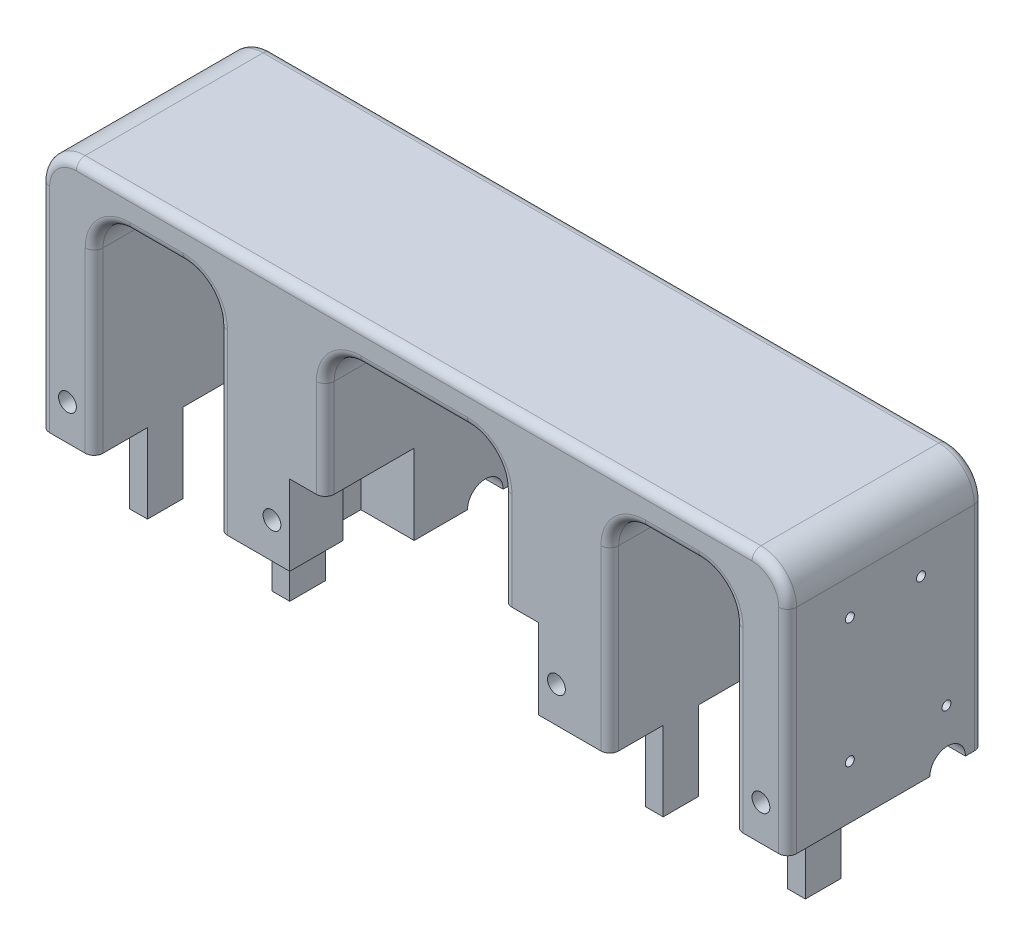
SolidWorks part; units mm, degrees
ref_plane "Front Plane" through (0, 0, 0) normal (0, 0, 1) x (1, 0, 0)
ref_plane "Top Plane" through (0, 0, 0) normal (0, 1, 0) x (1, 0, 0)
ref_plane "Right Plane" through (0, 0, 0) normal (1, 0, 0) x (0, 0, -1)
sketch "Sketch1" plane through (0, 0, 0) normal (0, 0, 1) x (1, 0, 0)
  line L5 (533.4, 406.4) -> (0, 406.4)
  line L7 (533.4, 406.4) -> (533.4, 533.4)
  line L8 (533.4, 533.4) -> (0, 533.4)
  line L9 (0, 406.4) -> (0, 533.4)
  line L10 (0, 406.4) -> (0, 0)
  line L16 (533.4, 406.4) -> (533.4, 0)
  line L17 (533.4, 406.4) -> (0, 533.4) construction
  line L18 (533.4, 0) -> (0, 0)
  line L19 (533.4, 533.4) -> (0, 406.4) construction
  line L24 (0, 406.4) -> (533.4, 406.4)
  point P2 (266.7, 469.9)
  dimension "D1" = 406.4
  dimension "D2" = 533.4
  dimension "D3" = 127
extrude "Boss-Extrude1" add sketch "Sketch1" along normal blind 139.7 contours L24 L10 L18 L16 | L9 L5 L7 L8
sketch "Sketch3" plane through (0, 533.4, 0) normal (0, 1, 0) x (1, 0, 0)
  line L0 (127, -101.6) -> (139.7, -101.6)
  line L1 (406.4, -101.6) -> (393.7, -101.6)
  line L2 (0, -139.7) -> (0, 0) construction
  line L3 (355.6, -101.6) -> (368.3, -101.6)
  line L6 (355.6, -155.448) -> (177.8, -155.448)
  line L8 (533.4, 0) -> (0, 0) construction
  line L10 (495.3, -155.448) -> (406.4, -155.448)
  line L11 (495.3, -155.448) -> (495.3, -101.6)
  line L13 (406.4, -155.448) -> (406.4, -101.6)
  line L15 (38.1, -155.448) -> (127, -155.448)
  line L16 (38.1, -155.448) -> (38.1, -101.6)
  line L17 (127, -155.448) -> (127, -101.6)
  line L18 (533.4, -76.2) -> (0, -76.2) construction
  line L23 (139.7, -76.2) -> (139.7, -101.6)
  line L24 (508, -76.2) -> (393.7, -76.2)
  line L25 (508, -76.2) -> (508, -101.6)
  line L26 (508, -101.6) -> (495.3, -101.6)
  line L27 (393.7, -76.2) -> (393.7, -101.6)
  line L28 (266.7, -76.2) -> (266.7, 0) construction
  line L29 (177.8, -101.6) -> (177.8, -155.448)
  line L30 (165.1, -76.2) -> (368.3, -76.2)
  line L31 (165.1, -76.2) -> (165.1, -101.6)
  line L32 (165.1, -101.6) -> (177.8, -101.6)
  line L33 (368.3, -76.2) -> (368.3, -101.6)
  line L36 (25.4, -101.6) -> (38.1, -101.6)
  line L37 (25.4, -76.2) -> (25.4, -101.6)
  line L38 (25.4, -76.2) -> (139.7, -76.2)
  line L39 (355.6, -101.6) -> (355.6, -155.448)
  dimension "D1" = 25.4
  dimension "D2" = 38.1
  dimension "D3" = 127
  dimension "D4" = 165.1
  dimension "D5" = 266.7
  dimension "D6" = 393.7
  dimension "D7" = 76.2
  dimension "D8" = 101.6
  dimension "D9" = 155.448
extrude "Cut-Extrude1" cut sketch "Sketch3" against normal through all both and the other way through all
sketch "Sketch4" plane through (0, 533.4, 0) normal (0, 1, 0) x (1, 0, 0)
  line L0 (266.7, -104.648) -> (266.7, 0)
  line L3 (127, -101.6) -> (127, -139.7) construction
  line L4 (177.8, -139.7) -> (127, -139.7) construction
  line L5 (203.2, -104.648) -> (330.2, -104.648)
  line L6 (203.2, -104.648) -> (203.2, 0)
  line L7 (203.2, 0) -> (330.2, 0)
  line L8 (330.2, -104.648) -> (330.2, 0)
  line L9 (203.2, -104.648) -> (330.2, 0) construction
  line L10 (203.2, 0) -> (330.2, -104.648) construction
  point P8 (266.7, -52.324)
  dimension "D1" = 76.2
  dimension "D2" = 139.7
  dimension "D3" = 35.052
  dimension "D4" = 87.376
extrude "Cut-Extrude2" cut sketch "Sketch4" against normal blind 292.1
sketch "Sketch5" plane through (0, 533.4, 0) normal (0, 1, 0) x (1, 0, 0)
  line L0 (82.55, -101.6) -> (82.55, 0)
  line L3 (266.7, 0) -> (266.7, -76.2)
  line L4 (38.1, -101.6) -> (127, -101.6)
  line L5 (38.1, -101.6) -> (38.1, 0)
  line L6 (38.1, 0) -> (127, 0)
  line L7 (127, -101.6) -> (127, 0)
  line L8 (38.1, -101.6) -> (127, 0) construction
  line L9 (38.1, 0) -> (127, -101.6) construction
  line L12 (495.3, 0) -> (406.4, -101.6) construction
  line L13 (495.3, -101.6) -> (406.4, 0) construction
  line L14 (406.4, -101.6) -> (406.4, 0)
  line L15 (495.3, 0) -> (406.4, 0)
  line L16 (495.3, -101.6) -> (495.3, 0)
  line L17 (495.3, -101.6) -> (406.4, -101.6)
  line L18 (450.85, -101.6) -> (450.85, 0)
  line L19 (406.4, -139.7) -> (406.4, -101.6) construction
  line L20 (406.4, -139.7) -> (406.4, -101.6) construction
  point P6 (82.55, -50.8)
  point P23 (450.85, -50.8)
  dimension "D1" = 82.55
  dimension "D2" = 127
  dimension "D4" = 266.7
  dimension "D5" = 50.8
  dimension "D6" = 76.2
extrude "Cut-Extrude3" cut sketch "Sketch5" against normal blind 292.1
sketch "Sketch7" plane through (533.4, 0, 0) normal (1, 0, 0) x (0, 0, -1)
  line L3 (0, 533.4) -> (0, 0) construction
  line L4 (-139.7, 533.4) -> (0, 533.4) construction
  circle A0 centre (-25.4, 508) radius 12.7
  dimension "D1" = 25.4
  dimension "D2" = 25.4
  dimension "D3" = 25.4
extrude "Cut-Extrude4" cut sketch "Sketch7" against normal through all
chamfer "Chamfer1" distance 76.2 angle 45 3 edges at (82.55, 241.3, 76.2) (450.85, 241.3, 76.2) (266.7, 241.3, 76.2)
fillet "Fillet1" radius 12.7 3 edges at (82.55, 241.3, 0) (266.7, 241.3, 0) (450.85, 241.3, 0)
fillet "Fillet2" radius 19.05 1 edges at (450.85, 165.1, 76.2)
fillet "Fillet3" radius 25.4 1 edges at (266.7, 165.1, 76.2)
sketch "Sketch8" plane through (0, 533.4, 0) normal (0, 1, 0) x (1, 0, 0)
  line L0 (533.4, 0) -> (495.3, 0) construction
  line L1 (495.3, 0) -> (495.3, -76.2) construction
  line L2 (495.3, -76.2) -> (508, -76.2) construction
  line L3 (508, -76.2) -> (508, -101.6) construction
  line L4 (508, -101.6) -> (495.3, -101.6) construction
  line L5 (495.3, -101.6) -> (495.3, -139.7) construction
  line L6 (495.3, -139.7) -> (533.4, -139.7) construction
  line L7 (533.4, -139.7) -> (533.4, 0) construction
  line L8 (38.1, -76.2) -> (38.1, 0) construction
  line L9 (38.1, 0) -> (0, 0) construction
  line L10 (0, 0) -> (0, -139.7) construction
  line L11 (0, -139.7) -> (38.1, -139.7) construction
  line L12 (38.1, -139.7) -> (38.1, -101.6) construction
  line L13 (38.1, -101.6) -> (25.4, -101.6) construction
  line L14 (25.4, -101.6) -> (25.4, -76.2) construction
  line L15 (25.4, -76.2) -> (38.1, -76.2) construction
  line L16 (203.2, 0) -> (127, 0) construction
  line L17 (127, 0) -> (127, -76.2) construction
  line L18 (127, -76.2) -> (139.7, -76.2) construction
  line L19 (139.7, -76.2) -> (139.7, -101.6) construction
  line L20 (139.7, -101.6) -> (127, -101.6) construction
  line L21 (127, -101.6) -> (127, -139.7) construction
  line L22 (127, -139.7) -> (177.8, -139.7) construction
  line L23 (177.8, -139.7) -> (177.8, -101.6) construction
  line L24 (177.8, -101.6) -> (165.1, -101.6) construction
  line L25 (165.1, -101.6) -> (165.1, -76.2) construction
  line L26 (165.1, -76.2) -> (203.2, -76.2) construction
  line L27 (203.2, -76.2) -> (203.2, 0) construction
  line L28 (406.4, -76.2) -> (406.4, 0) construction
  line L29 (406.4, 0) -> (330.2, 0) construction
  line L30 (330.2, 0) -> (330.2, -76.2) construction
  line L31 (330.2, -76.2) -> (368.3, -76.2) construction
  line L32 (368.3, -76.2) -> (368.3, -101.6) construction
  line L33 (368.3, -101.6) -> (355.6, -101.6) construction
  line L34 (355.6, -101.6) -> (355.6, -139.7) construction
  line L35 (355.6, -139.7) -> (406.4, -139.7) construction
  line L36 (406.4, -139.7) -> (406.4, -101.6) construction
  line L37 (406.4, -101.6) -> (393.7, -101.6) construction
  line L38 (393.7, -101.6) -> (393.7, -76.2) construction
  line L39 (393.7, -76.2) -> (406.4, -76.2) construction
  line L40 (533.4, 0) -> (495.3, 0)
  line L41 (495.3, 0) -> (495.3, -76.2)
  line L42 (495.3, -76.2) -> (508, -76.2)
  line L43 (508, -76.2) -> (508, -101.6)
  line L44 (508, -101.6) -> (495.3, -101.6)
  line L45 (495.3, -101.6) -> (495.3, -139.7)
  line L46 (495.3, -139.7) -> (533.4, -139.7)
  line L47 (533.4, -139.7) -> (533.4, 0)
  line L48 (38.1, -76.2) -> (38.1, 0)
  line L49 (38.1, 0) -> (0, 0)
  line L50 (0, 0) -> (0, -139.7)
  line L51 (0, -139.7) -> (38.1, -139.7)
  line L52 (38.1, -139.7) -> (38.1, -101.6)
  line L53 (38.1, -101.6) -> (25.4, -101.6)
  line L54 (25.4, -101.6) -> (25.4, -76.2)
  line L55 (25.4, -76.2) -> (38.1, -76.2)
  line L56 (203.2, 0) -> (127, 0)
  line L57 (127, 0) -> (127, -76.2)
  line L58 (127, -76.2) -> (139.7, -76.2)
  line L59 (139.7, -76.2) -> (139.7, -101.6)
  line L60 (139.7, -101.6) -> (127, -101.6)
  line L61 (127, -101.6) -> (127, -139.7)
  line L62 (127, -139.7) -> (177.8, -139.7)
  line L63 (177.8, -139.7) -> (177.8, -101.6)
  line L64 (177.8, -101.6) -> (165.1, -101.6)
  line L65 (165.1, -101.6) -> (165.1, -76.2)
  line L66 (165.1, -76.2) -> (203.2, -76.2)
  line L67 (203.2, -76.2) -> (203.2, 0)
  line L68 (406.4, -76.2) -> (406.4, 0)
  line L69 (406.4, 0) -> (330.2, 0)
  line L70 (330.2, 0) -> (330.2, -76.2)
  line L71 (330.2, -76.2) -> (368.3, -76.2)
  line L72 (368.3, -76.2) -> (368.3, -101.6)
  line L73 (368.3, -101.6) -> (355.6, -101.6)
  line L74 (355.6, -101.6) -> (355.6, -139.7)
  line L75 (355.6, -139.7) -> (406.4, -139.7)
  line L76 (406.4, -139.7) -> (406.4, -101.6)
  line L77 (406.4, -101.6) -> (393.7, -101.6)
  line L78 (393.7, -101.6) -> (393.7, -76.2)
  line L79 (393.7, -76.2) -> (406.4, -76.2)
extrude "Boss-Extrude3" add sketch "Sketch8" along normal blind 127
sketch "Sketch9" plane through (0, 660.4, 0) normal (0, 1, 0) x (1, 0, 0)
  line L1 (0, 0) -> (533.4, 0)
  line L2 (0, 0) -> (0, -139.7)
  line L3 (0, -139.7) -> (533.4, -139.7)
  line L4 (533.4, 0) -> (533.4, -139.7)
  line L5 (0, 0) -> (533.4, -139.7) construction
  line L6 (0, -139.7) -> (533.4, 0) construction
  point P4 (266.7, -69.85)
extrude "Boss-Extrude4" add sketch "Sketch9" along normal blind 25.4
sketch "Sketch11" plane through (533.4, 0, 0) normal (1, 0, 0) x (0, 0, -1)
  line L0 (0, 508) -> (-139.7, 508)
  line L1 (0, 685.8) -> (0, 0) construction
  line L2 (-139.7, 685.8) -> (-139.7, 0) construction
  line L7 (0, 0) -> (0, 685.8)
  line L8 (0, 685.8) -> (-139.7, 685.8)
  line L9 (-139.7, 685.8) -> (-139.7, 0)
  line L10 (-139.7, 0) -> (0, 0)
  line L11 (0, 0) -> (0, 685.8)
  line L12 (0, 685.8) -> (-139.7, 685.8)
  line L13 (-139.7, 685.8) -> (-139.7, 0)
  line L14 (-139.7, 0) -> (0, 0)
  dimension "D1" = 0
extrude "Cut-Extrude5" cut sketch "Sketch11" against normal through all contours L0 M7 M6 M9 M10
sketch "Sketch13" plane through (0, 0, 0) normal (0, 0, -1) x (-1, 0, 0)
  line L0 (-495.3, 508) -> (-533.4, 508) construction
  line L1 (-330.2, 508) -> (-406.4, 508) construction
  line L2 (-514.35, 508) -> (-514.35, 693.4168)
  line L3 (-368.3, 508) -> (-368.3, 706.1947)
  line L4 (-266.7, 685.8) -> (-266.7, 472.1492)
  line L5 (-533.4, 685.8) -> (0, 685.8) construction
  circle A0 centre (-514.35, 533.4) radius 6.35
  circle A1 centre (-368.3, 533.4) radius 6.35
  circle A2 centre (-165.1, 533.4) radius 6.35
  circle A3 centre (-19.05, 533.4) radius 6.35
  point P16 (-19.05, 533.4)
  dimension "D1" = 12.7
  dimension "D2" = 12.7
  dimension "D3" = 25.4
  dimension "D4" = 25.4
extrude "Cut-Extrude11" cut sketch "Sketch13" against normal blind 25.4 contours L2 A0 | L2 A0 | L3 A1 | L3 A1 | A2 | A3
ref_plane "Plane1" through (0, 0, 69.85) normal (0, 0, -1) x (-1, 0, 0)
mirror "Mirror1" about plane through (0, 0, 69.85) normal (0, 0, -1) of "Cut-Extrude11"
sketch "Sketch14" plane through (0, 660.4, 0) normal (0, -1, 0) x (1, 0, 0)
  line L0 (495.3, 139.7) -> (406.4, 139.7) construction
  line L1 (406.4, 139.7) -> (406.4, 101.6) construction
  line L2 (406.4, 101.6) -> (393.7, 101.6) construction
  line L3 (393.7, 101.6) -> (393.7, 76.2) construction
  line L4 (393.7, 76.2) -> (406.4, 76.2) construction
  line L5 (406.4, 76.2) -> (406.4, 0) construction
  line L6 (406.4, 0) -> (495.3, 0) construction
  line L7 (495.3, 0) -> (495.3, 76.2) construction
  line L8 (495.3, 76.2) -> (508, 76.2) construction
  line L9 (508, 76.2) -> (508, 101.6) construction
  line L10 (508, 101.6) -> (495.3, 101.6) construction
  line L11 (495.3, 101.6) -> (495.3, 139.7) construction
  line L12 (355.6, 139.7) -> (177.8, 139.7) construction
  line L13 (177.8, 139.7) -> (177.8, 101.6) construction
  line L14 (177.8, 101.6) -> (165.1, 101.6) construction
  line L15 (165.1, 101.6) -> (165.1, 76.2) construction
  line L16 (165.1, 76.2) -> (203.2, 76.2) construction
  line L17 (203.2, 76.2) -> (203.2, 0) construction
  line L18 (203.2, 0) -> (330.2, 0) construction
  line L19 (330.2, 0) -> (330.2, 76.2) construction
  line L20 (330.2, 76.2) -> (368.3, 76.2) construction
  line L21 (368.3, 76.2) -> (368.3, 101.6) construction
  line L22 (368.3, 101.6) -> (355.6, 101.6) construction
  line L23 (355.6, 101.6) -> (355.6, 139.7) construction
  line L24 (127, 139.7) -> (38.1, 139.7) construction
  line L25 (38.1, 139.7) -> (38.1, 101.6) construction
  line L26 (38.1, 101.6) -> (25.4, 101.6) construction
  line L27 (25.4, 101.6) -> (25.4, 76.2) construction
  line L28 (25.4, 76.2) -> (38.1, 76.2) construction
  line L29 (38.1, 76.2) -> (38.1, 0) construction
  line L30 (38.1, 0) -> (127, 0) construction
  line L31 (127, 0) -> (127, 76.2) construction
  line L32 (127, 76.2) -> (139.7, 76.2) construction
  line L33 (139.7, 76.2) -> (139.7, 101.6) construction
  line L34 (139.7, 101.6) -> (127, 101.6) construction
  line L35 (127, 101.6) -> (127, 139.7) construction
  line L36 (495.3, 139.7) -> (406.4, 139.7)
  line L37 (406.4, 139.7) -> (406.4, 101.6)
  line L38 (406.4, 101.6) -> (393.7, 101.6)
  line L39 (393.7, 101.6) -> (393.7, 76.2)
  line L40 (393.7, 76.2) -> (406.4, 76.2)
  line L41 (406.4, 76.2) -> (406.4, 0)
  line L42 (406.4, 0) -> (495.3, 0)
  line L43 (495.3, 0) -> (495.3, 76.2)
  line L44 (495.3, 76.2) -> (508, 76.2)
  line L45 (508, 76.2) -> (508, 101.6)
  line L46 (508, 101.6) -> (495.3, 101.6)
  line L47 (495.3, 101.6) -> (495.3, 139.7)
  line L48 (355.6, 139.7) -> (177.8, 139.7)
  line L49 (177.8, 139.7) -> (177.8, 101.6)
  line L50 (177.8, 101.6) -> (165.1, 101.6)
  line L51 (165.1, 101.6) -> (165.1, 76.2)
  line L52 (165.1, 76.2) -> (203.2, 76.2)
  line L53 (203.2, 76.2) -> (203.2, 0)
  line L54 (203.2, 0) -> (330.2, 0)
  line L55 (330.2, 0) -> (330.2, 76.2)
  line L56 (330.2, 76.2) -> (368.3, 76.2)
  line L57 (368.3, 76.2) -> (368.3, 101.6)
  line L58 (368.3, 101.6) -> (355.6, 101.6)
  line L59 (355.6, 101.6) -> (355.6, 139.7)
  line L60 (127, 139.7) -> (38.1, 139.7)
  line L61 (38.1, 139.7) -> (38.1, 101.6)
  line L62 (38.1, 101.6) -> (25.4, 101.6)
  line L63 (25.4, 101.6) -> (25.4, 76.2)
  line L64 (25.4, 76.2) -> (38.1, 76.2)
  line L65 (38.1, 76.2) -> (38.1, 0)
  line L66 (38.1, 0) -> (127, 0)
  line L67 (127, 0) -> (127, 76.2)
  line L68 (127, 76.2) -> (139.7, 76.2)
  line L69 (139.7, 76.2) -> (139.7, 101.6)
  line L70 (139.7, 101.6) -> (127, 101.6)
  line L71 (127, 101.6) -> (127, 139.7)
  line L72 (203.2, 76.2) -> (203.2, 139.7)
  line L73 (203.2, 139.7) -> (177.8, 139.7)
  line L74 (38.1, 76.2) -> (38.1, 139.7)
  line L75 (127, 76.2) -> (127, 139.7)
extrude "Boss-Extrude5" add sketch "Sketch14" along normal blind 209.042 contours L74 M5 M3 M4 | L75 M9 M10 M11
ref_plane "Plane2" through (266.7, 0, 0) normal (1, 0, 0) x (0, 0, -1)
mirror "Mirror3" about plane through (266.7, 0, 0) normal (1, 0, 0) of "Boss-Extrude5"
fillet "Fillet4" radius 25.4 8 edges at (533.4, 685.8, 69.85) (0, 685.8, 69.85) (495.3, 660.4, 69.85) (406.4, 660.4, 69.85) (330.2, 660.4, 38.1) (127, 660.4, 69.85) (203.2, 660.4, 38.1) (38.1, 660.4, 69.85)
fillet "Fillet6" radius 50.8 2 edges at (355.6, 660.4, 120.65) (177.8, 660.4, 120.65)
sketch "Sketch15" plane through (0, 0, 76.2) normal (0, 0, 1) x (1, 0, 0)
  line L0 (330.2, 635) -> (330.2, 508) construction
  line L1 (330.2, 508) -> (368.3, 508) construction
  line L2 (368.3, 508) -> (368.3, 660.4) construction
  line L3 (368.3, 660.4) -> (304.8, 660.4) construction
  line L4 (165.1, 660.4) -> (165.1, 508) construction
  line L5 (165.1, 508) -> (203.2, 508) construction
  line L6 (203.2, 508) -> (203.2, 635) construction
  line L7 (228.6, 660.4) -> (165.1, 660.4) construction
  line L8 (330.2, 635) -> (330.2, 508)
  line L9 (330.2, 508) -> (368.3, 508)
  line L10 (368.3, 508) -> (368.3, 660.4)
  line L11 (368.3, 660.4) -> (304.8, 660.4)
  line L12 (165.1, 660.4) -> (165.1, 508)
  line L13 (165.1, 508) -> (203.2, 508)
  line L14 (203.2, 508) -> (203.2, 635)
  line L15 (228.6, 660.4) -> (165.1, 660.4)
  line L16 (203.2, 565.15) -> (165.1, 565.15)
  line L17 (165.1, 565.15) -> (368.3, 565.15)
  arc A0 (330.2, 635) -> (304.8, 660.4) centre (304.8, 635) ccw construction
  arc A1 (228.6, 660.4) -> (203.2, 635) centre (228.6, 635) ccw construction
  arc A2 (330.2, 635) -> (304.8, 660.4) centre (304.8, 635) ccw
  arc A3 (228.6, 660.4) -> (203.2, 635) centre (228.6, 635) ccw
  dimension "D1" = 57.15
extrude "Boss-Extrude6" add sketch "Sketch15" along normal up to surface (63.5 mm away) contours L16 L14 M4 M5 M1 | A2 L8 L17 L10 L11
fillet "Fillet5" radius 6.35 25 edges at (0, 584.2, 139.7) (0, 584.2, 0) (7.4395, 678.3605, 0) (7.4395, 678.3605, 139.7) (266.7, 685.8, 0) (533.4, 584.2, 0) (533.4, 584.2, 139.7) (406.4, 571.5, 139.7) (495.3, 571.5, 139.7) (487.8605, 652.9605, 139.7) (450.85, 660.4, 139.7) (38.1, 571.5, 139.7) (45.5395, 652.9605, 139.7) (82.55, 660.4, 139.7) (127, 571.5, 139.7) (266.7, 685.8, 139.7) (525.9605, 678.3605, 139.7) (525.9605, 678.3605, 0) (413.8395, 652.9605, 139.7) (119.5605, 652.9605, 139.7) (203.2, 600.075, 139.7) (330.2, 600.075, 139.7) (322.7605, 652.9605, 139.7) (266.7, 660.4, 139.7) (210.6395, 652.9605, 139.7)
fillet "Fillet7" radius 6.35 15 edges at (38.1, 571.5, 0) (45.5395, 652.9605, 0) (82.55, 660.4, 0) (119.5605, 652.9605, 0) (203.2, 571.5, 0) (210.6395, 652.9605, 0) (266.7, 660.4, 0) (322.7605, 652.9605, 0) (495.3, 571.5, 0) (487.8605, 652.9605, 0) (450.85, 660.4, 0) (413.8395, 652.9605, 0) (127, 571.5, 0) (330.2, 571.5, 0) (406.4, 571.5, 0)
sketch "Sketch17" plane through (533.4, 0, 0) normal (1, 0, 0) x (0, 0, -1)
  line L0 (-38.1, 508) -> (-133.35, 508) construction
  line L1 (-133.35, 660.4) -> (-133.35, 508) construction
  line L2 (-6.35, 660.4) -> (-133.35, 660.4) construction
  line L3 (-6.35, 508) -> (-6.35, 660.4) construction
  circle A0 centre (-95.25, 546.1) radius 3.175
  circle A3 centre (-26.2526, 546.0905) radius 3.175
  circle A4 centre (-95.25, 635) radius 3.175
  circle A5 centre (-44.45, 635) radius 3.175
  dimension "D3" = 38.1
  dimension "D4" = 25.4
  dimension "D5" = 38.1
  dimension "D6" = 25.4
  dimension "D7" = 38.1
  dimension "D8" = 6.35
  dimension "D9" = 19.9026
  dimension "D1" = 38.1
  dimension "D2" = 38.1
extrude "Cut-Extrude12" cut sketch "Sketch17" against normal blind 25.4
ref_plane "Plane3" through (266.7, 0, 0) normal (1, 0, 0) x (0, 0, -1)
mirror "Mirror4" about plane through (266.7, 0, 0) normal (1, 0, 0) of "Cut-Extrude12"
